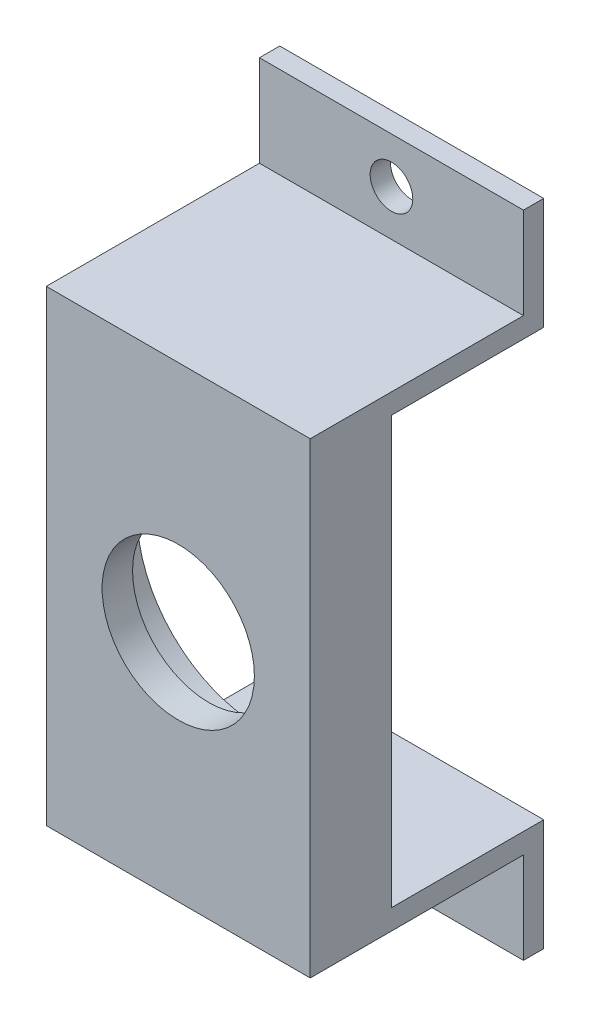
SolidWorks part; units mm, degrees
ref_plane "前视基准面" through (0, 0, 0) normal (0, 0, 1) x (1, 0, 0)
ref_plane "上视基准面" through (0, 0, 0) normal (0, 1, 0) x (1, 0, 0)
ref_plane "右视基准面" through (0, 0, 0) normal (1, 0, 0) x (0, 0, -1)
other "Configuration Table"
sketch "草图1" plane through (0, 0, 0) normal (0, 0, 1) x (1, 0, 0)
  line L1 (-15, -30.5) -> (15, -30.5)
  line L2 (-15, -30.5) -> (-15, 30.5)
  line L3 (-15, 30.5) -> (15, 30.5)
  line L4 (15, -30.5) -> (15, 30.5)
  line L5 (-15, -30.5) -> (15, 30.5) construction
  line L6 (-15, 30.5) -> (15, -30.5) construction
  point P0 (0, 0)
  dimension "D1" = 30
  dimension "D2" = 61
extrude "凸台-拉伸1" add sketch "草图1" along normal blind 2
sketch "草图2" plane through (0, 0, 2) normal (0, 0, 1) x (1, 0, 0)
  circle A0 centre (0, 0) radius 6
  dimension "D1" = 12
extrude "切除-拉伸1" cut sketch "草图2" against normal blind 2
hole_wizard "M4 螺纹孔1" positions "草图3" profile "草图4" tap size "M4" standard "GB"
sketch "草图3" plane through (0, 0, 2) normal (0, 0, 1) x (1, 0, 0)
  line L0 (15, 30.5) -> (-15, 30.5) construction
  line L1 (-15, -30.5) -> (15, -30.5) construction
  point P0 (0, 22.5)
  point P2 (0, -22.5)
  dimension "D1" = 8
  dimension "D2" = 8
sketch "草图4" plane through (0, 22.5, 2) normal (1, 0, 0) x (0, -1, 0)
  line L0 (0, 0) -> (0, 2)
  line L1 (0, 2) -> (1.65, 2)
  line L2 (1.65, 2) -> (1.65, 0)
  line L5 (1.65, 0) -> (0, 0)
  line L11 (0, -6.35) -> (0, 107.95) construction
  dimension "通孔螺纹孔钻头直径" = 3.3
  dimension "通孔螺纹孔钻头深度" = 2
sketch "草图5" plane through (0, 0, 2) normal (0, 0, 1) x (1, 0, 0)
  line L0 (15, -30.5) -> (15, 30.5) construction
  line L1 (-15, 30.5) -> (15, 30.5)
  line L2 (-15, 30.5) -> (-15, 27.5)
  line L3 (-15, 27.5) -> (15, 27.5)
  line L4 (15, 30.5) -> (15, 27.5)
  line L5 (-15, 30.5) -> (-15, -30.5) construction
  line L6 (-15, -27.5) -> (15, -27.5)
  line L7 (-15, -27.5) -> (-15, -30.5)
  line L8 (-15, -30.5) -> (15, -30.5)
  line L9 (15, -27.5) -> (15, -30.5)
  dimension "D1" = 3
  dimension "D2" = 3
extrude "凸台-拉伸2" add sketch "草图5" along normal blind 15
sketch "草图6" plane through (0, 0, 17) normal (0, 0, 1) x (1, 0, 0)
  line L1 (-15, 30.5) -> (15, 30.5)
  line L2 (-15, 30.5) -> (-15, -30.5)
  line L3 (-15, -30.5) -> (15, -30.5)
  line L4 (15, 30.5) -> (15, -30.5)
extrude "凸台-拉伸3" add sketch "草图6" along normal blind 8
sketch "草图7" plane through (0, 0, 25) normal (0, 0, 1) x (1, 0, 0)
  circle A0 centre (0, 0) radius 7.5
  dimension "D1" = 15
extrude "切除-拉伸2" cut sketch "草图7" against normal blind 8
sketch "草图8" plane through (0, 0, 17) normal (0, 0, -1) x (-1, 0, 0)
  circle A0 centre (0, 0) radius 12.05
  dimension "D1" = 24.1
extrude "切除-拉伸3" cut sketch "草图8" against normal blind 5
sketch "草图12" plane through (0, 0, 0) normal (0, 0, -1) x (-1, 0, 0)
  line L1 (-19.8276, 38.3333) -> (31.7241, 38.3333)
  line L2 (-19.8276, 38.3333) -> (-19.8276, -43.0105)
  line L3 (-19.8276, -43.0105) -> (31.7241, -43.0105)
  line L4 (31.7241, 38.3333) -> (31.7241, -43.0105)
extrude "切除-拉伸5" cut sketch "草图12" against normal up to surface (17 mm away)
sketch "草图13" plane through (0, 30.5, 0) normal (0, 1, 0) x (1, 0, 0)
  line L4 (15, -25) -> (15, -17)
  line L5 (15, -17) -> (-15, -17)
  line L6 (-15, -17) -> (-15, -25)
  line L7 (-15, -25) -> (15, -25)
  line L8 (15, -25) -> (15, -17)
  line L9 (15, -17) -> (-15, -17)
  line L10 (-15, -17) -> (-15, -25)
  line L11 (-15, -25) -> (15, -25)
  dimension "D1" = 0
extrude "切除-拉伸6" cut sketch "草图13" against normal blind 9.5
sketch "草图14" plane through (0, -30.5, 0) normal (0, -1, 0) x (1, 0, 0)
  line L4 (-15, 25) -> (-15, 17)
  line L5 (-15, 17) -> (15, 17)
  line L6 (15, 17) -> (15, 25)
  line L7 (15, 25) -> (-15, 25)
  line L8 (-15, 25) -> (-15, 17)
  line L9 (-15, 17) -> (15, 17)
  line L10 (15, 17) -> (15, 25)
  line L11 (15, 25) -> (-15, 25)
  dimension "D1" = 0
extrude "切除-拉伸7" cut sketch "草图14" against normal blind 9.5
sketch "草图15" plane through (0, -21, 0) normal (0, -1, 0) x (1, 0, 0)
  line L4 (15, 25) -> (-15, 25)
  line L5 (-15, 25) -> (-15, 17)
  line L6 (-15, 17) -> (15, 17)
  line L7 (15, 17) -> (15, 25)
  line L8 (15, 25) -> (-15, 25)
  line L9 (-15, 25) -> (-15, 17)
  line L10 (-15, 17) -> (15, 17)
  line L11 (15, 17) -> (15, 25)
  dimension "D1" = 0
extrude "凸台-拉伸6" add sketch "草图15" along normal blind 2
sketch "草图16" plane through (0, 21, 0) normal (0, 1, 0) x (1, 0, 0)
  line L4 (-15, -25) -> (15, -25)
  line L5 (15, -25) -> (15, -17)
  line L6 (15, -17) -> (-15, -17)
  line L7 (-15, -17) -> (-15, -25)
  line L8 (-15, -25) -> (15, -25)
  line L9 (15, -25) -> (15, -17)
  line L10 (15, -17) -> (-15, -17)
  line L11 (-15, -17) -> (-15, -25)
  dimension "D1" = 0
extrude "凸台-拉伸7" add sketch "草图16" along normal blind 2
sketch "草图17" plane through (0, 0, 17) normal (0, 0, -1) x (-1, 0, 0)
  line L0 (15, 23) -> (15, -23) construction
  line L1 (-15, 23) -> (15, 23)
  line L2 (-15, 23) -> (-15, 21)
  line L3 (-15, 21) -> (15, 21)
  line L4 (15, 23) -> (15, 21)
  line L5 (-15, -23) -> (-15, 23) construction
  line L6 (-15, -21) -> (15, -21)
  line L7 (-15, -21) -> (-15, -23)
  line L8 (-15, -23) -> (15, -23)
  line L9 (15, -21) -> (15, -23)
  line L10 (15, -23) -> (-15, -23) construction
  dimension "D1" = 2
  dimension "D2" = 2
extrude "凸台-拉伸8" add sketch "草图17" along normal blind 15
sketch "草图18" plane through (0, 23, 0) normal (0, 1, 0) x (1, 0, 0)
  line L0 (15, -25) -> (15, -2) construction
  line L1 (-15, -2) -> (15, -2)
  line L2 (-15, -2) -> (-15, -4)
  line L3 (-15, -4) -> (15, -4)
  line L4 (15, -2) -> (15, -4)
  dimension "D1" = 2
extrude "凸台-拉伸9" add sketch "草图18" along normal blind 9
sketch "草图19" plane through (0, -23, 0) normal (0, -1, 0) x (1, 0, 0)
  line L0 (-15, 25) -> (-15, 2) construction
  line L1 (-15, 4) -> (15, 4)
  line L2 (-15, 4) -> (-15, 2)
  line L3 (-15, 2) -> (15, 2)
  line L4 (15, 4) -> (15, 2)
  line L5 (15, 2) -> (15, 25) construction
  line L6 (15, 2) -> (-15, 2) construction
  dimension "D1" = 2
extrude "凸台-拉伸10" add sketch "草图19" along normal blind 9
hole_wizard "M5 螺纹孔1" positions "草图20" profile "草图21" tap size "M5" standard "GB"
sketch "草图20" plane through (0, 0, 4) normal (0, 0, 1) x (1, 0, 0)
  point P0 (0, 27.5)
  point P2 (0, -27.5)
  dimension "D1" = 27.5
  dimension "D2" = 27.5
sketch "草图21" plane through (0, 27.5, 4) normal (1, 0, 0) x (0, -1, 0)
  line L0 (0, 0) -> (0, 2)
  line L1 (0, 2) -> (2.1, 2)
  line L2 (2.1, 2) -> (2.1, 0)
  line L5 (2.1, 0) -> (0, 0)
  line L11 (0, -6.35) -> (0, 107.95) construction
  dimension "通孔螺纹孔钻头直径" = 4.2
  dimension "通孔螺纹孔钻头深度" = 2
sketch "草图22" plane through (-15, 0, 0) normal (-1, 0, 0) x (0, 0, 1)
  line L12 (25, 23) -> (4, 23)
  line L13 (4, 23) -> (4, 32)
  line L14 (4, 32) -> (2, 32)
  line L15 (2, 32) -> (2, 21)
  line L16 (2, 21) -> (17, 21)
  line L17 (17, 21) -> (17, -21)
  line L18 (17, -21) -> (2, -21)
  line L19 (2, -21) -> (2, -32)
  line L20 (2, -32) -> (4, -32)
  line L21 (4, -32) -> (4, -23)
  line L22 (4, -23) -> (25, -23)
  line L23 (25, -23) -> (25, 23)
  line L24 (25, 23) -> (4, 23)
  line L25 (4, 23) -> (4, 32)
  line L26 (4, 32) -> (2, 32)
  line L27 (2, 32) -> (2, 21)
  line L28 (2, 21) -> (17, 21)
  line L29 (17, 21) -> (17, -21)
  line L30 (17, -21) -> (2, -21)
  line L31 (2, -21) -> (2, -32)
  line L32 (2, -32) -> (4, -32)
  line L33 (4, -32) -> (4, -23)
  line L34 (4, -23) -> (25, -23)
  line L35 (25, -23) -> (25, 23)
  dimension "D1" = 0
extrude "切除-拉伸8" cut sketch "草图22" against normal blind 2
sketch "草图23" plane through (15, 0, 0) normal (1, 0, 0) x (0, 0, -1)
  line L12 (-25, 23) -> (-25, -23)
  line L13 (-25, -23) -> (-4, -23)
  line L14 (-4, -23) -> (-4, -32)
  line L15 (-4, -32) -> (-2, -32)
  line L16 (-2, -32) -> (-2, -21)
  line L17 (-2, -21) -> (-17, -21)
  line L18 (-17, -21) -> (-17, 21)
  line L19 (-17, 21) -> (-2, 21)
  line L20 (-2, 21) -> (-2, 32)
  line L21 (-2, 32) -> (-4, 32)
  line L22 (-4, 32) -> (-4, 23)
  line L23 (-4, 23) -> (-25, 23)
  line L24 (-25, 23) -> (-25, -23)
  line L25 (-25, -23) -> (-4, -23)
  line L26 (-4, -23) -> (-4, -32)
  line L27 (-4, -32) -> (-2, -32)
  line L28 (-2, -32) -> (-2, -21)
  line L29 (-2, -21) -> (-17, -21)
  line L30 (-17, -21) -> (-17, 21)
  line L31 (-17, 21) -> (-2, 21)
  line L32 (-2, 21) -> (-2, 32)
  line L33 (-2, 32) -> (-4, 32)
  line L34 (-4, 32) -> (-4, 23)
  line L35 (-4, 23) -> (-25, 23)
  dimension "D1" = 0
extrude "切除-拉伸9" cut sketch "草图23" against normal blind 2
